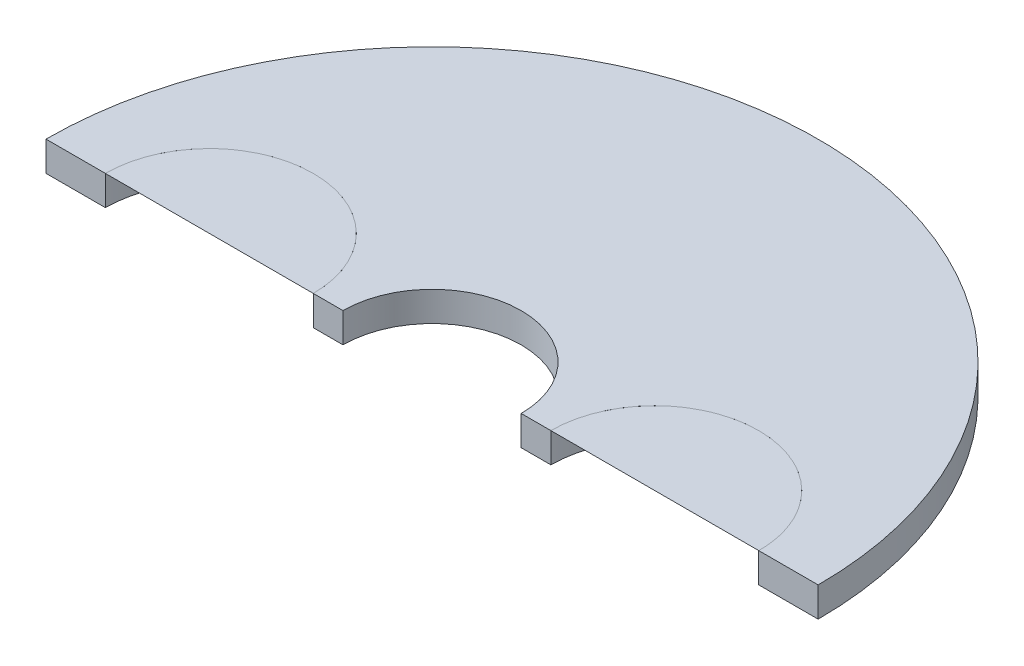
SolidWorks part; units mm, degrees
ref_plane "Face" through (0, 0, 0) normal (0, 0, 1) x (1, 0, 0)
ref_plane "Dessus" through (0, 0, 0) normal (0, 1, 0) x (1, 0, 0)
ref_plane "Droite" through (0, 0, 0) normal (1, 0, 0) x (0, 0, -1)
sketch "Esquisse1" plane through (0, 0, 0) normal (0, 1, 0) x (1, 0, 0)
  line L0 (-19.4333, 0) -> (15.1755, 0) construction
  circle A0 centre (0, 0) radius 13
  circle A1 centre (0, 0) radius 3
  circle A2 centre (7.5, 0) radius 3.5
  circle A3 centre (-7.5, 0) radius 3.5
  dimension "D1" = 26
  dimension "D2" = 6
  dimension "D5" = 7
  dimension "D6" = 7
  dimension "D3" = 7.5
  dimension "D4" = 7.5
extrude "Extrusion1" add sketch "Esquisse1" along normal blind 1
surface "Surface-Remplir1" [suppressed]
surface "Surface-Remplir2" [suppressed]
sketch "Esquisse2" plane through (0, 0, 0) normal (0, 0, 1) x (1, 0, 0)
  line L0 (13, 0) -> (13, 1) construction
  line L1 (0, 1) -> (13, 1)
  line L2 (0, 1) -> (0, 0)
  line L3 (0, 0) -> (13, 0)
  line L4 (13, 1) -> (13, 0)
  line L5 (-13, 0) -> (13, 0) construction
  line L6 (11, 1) -> (4, 1) construction
  line L7 (0, 0) -> (0, -2.5242) construction
revolve "Coupe" cut sketch "Esquisse2" angle 180 about L7
sketch "Esquisse3" plane through (0, 1, 0) normal (0, 1, 0) x (-1, 0, 0)
  line L0 (11, 0) -> (4, 0)
surface "Surface-Remplir3"
sketch "Esquisse4" plane through (0, 1, 0) normal (0, 1, 0) x (-1, 0, 0)
  line L0 (-4, 0) -> (-11, 0)
surface "Surface-Remplir4"
